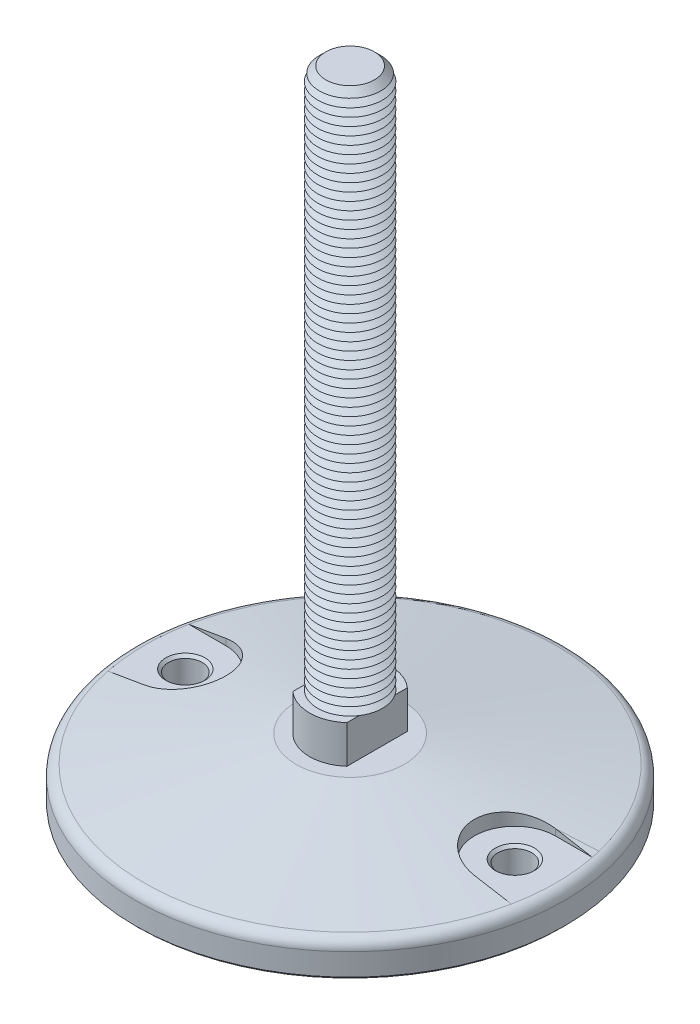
SolidWorks part; units mm, degrees
ref_plane "Front Plane" through (0, 0, 0) normal (0, 0, 1) x (1, 0, 0)
ref_plane "Top Plane" through (0, 0, 0) normal (0, 1, 0) x (1, 0, 0)
ref_plane "Right Plane" through (0, 0, 0) normal (1, 0, 0) x (0, 0, -1)
sketch "Sketch1" plane through (0, 0, 0) normal (1, 0, 0) x (0, 0, -1)
  line L0 (0, 61.3389) -> (0, -58.404) construction
sketch "Sketch2" plane through (0, 0, 0) normal (1, 0, 0) x (0, 0, -1)
  line L0 (0, 0) -> (-20, 0)
  line L1 (-20, 0) -> (-79.5, -10.4915)
  line L2 (-79.5, -10.4915) -> (-79.5, -23)
  line L3 (-79.5, -23) -> (0, -23)
  line L4 (0, 61.3389) -> (0, -58.404) construction
  line L5 (0, -23) -> (0, 0)
  dimension "D1" = 23
  dimension "D2" = 79.5
  dimension "D3" = 20
  dimension "D4" = 10
revolve "Revolve1" add sketch "Sketch2" angle 360 about L0
fillet "Fillet1" radius 4 1 edges at (0, -10.4915, 79.5)
sketch "Sketch3" plane through (0, 0, 0) normal (0, 1, 0) x (1, 0, 0)
  circle A0 centre (0, 0) radius 15
  dimension "D1" = 30
extrude "Boss-Extrude1" add sketch "Sketch3" along normal blind 14
sketch "Sketch4" plane through (0, 14, 0) normal (0, 1, 0) x (1, 0, 0)
  line L0 (-10, 11.1803) -> (-10, -11.1803)
  line L2 (10, -11.1803) -> (10, 11.1803)
  arc A0 (-10, 11.1803) -> (-10, -11.1803) centre (0, 0) ccw
  circle A1 centre (0, 0) radius 15 construction
  arc A2 (10, -11.1803) -> (10, 11.1803) centre (0, 0) ccw
  dimension "D1" = 20
extrude "Cut-Extrude1" cut sketch "Sketch4" against normal blind 14
sketch "Sketch5" plane through (0, 14, 0) normal (0, 1, 0) x (1, 0, 0)
  circle A0 centre (0, 0) radius 12
  dimension "D1" = 24
extrude "Boss-Extrude2" add sketch "Sketch5" along normal blind 200
chamfer "Chamfer1" distance 3 angle 45 1 edges at (0, 214, 12)
sketch "Sketch6" plane through (0, 0, 0) normal (1, 0, 0) x (0, 0, -1)
  line L0 (-12, 14) -> (-9.4019, 15.5)
  line L1 (-9.4019, 15.5) -> (-12, 17)
  line L2 (-12, 211) -> (-12, 14) construction
  line L3 (-12, 17) -> (-12, 14)
  dimension "D1" = 3
revolve "Cut-Revolve1" cut sketch "Sketch6" angle 360 about L0
pattern_linear "LPattern1" count 66 spacing 3 along (0, 1, 0) of "Cut-Revolve1"
sketch "Sketch8" plane through (0, 0, 0) normal (0, 1, 0) x (1, 0, 0)
  line L0 (-61, 15) -> (-74.7035, 15)
  line L1 (-61, -15) -> (-74.7035, -15)
  arc A1 (-74.7035, 15) -> (-74.7035, -15) centre (0, 0) ccw
  circle A2 centre (0, 0) radius 76.1946 construction
  arc A3 (-61, -15) -> (-61, 15) centre (-61, 0) ccw
  point P3 (-61, 0)
  point P11 (0, 0)
  dimension "D1" = 61
  dimension "D2" = 30
extrude "Cut-Extrude4" cut sketch "Sketch8" against normal blind 9.91
sketch "Sketch10" plane through (0, -9.91, 0) normal (0, 1, 0) x (1, 0, 0)
  circle A0 centre (-61, 0) radius 6.25
  dimension "D1" = 12.5
extrude "Cut-Extrude5" cut sketch "Sketch10" against normal up to surface (13.09 mm away)
chamfer "Chamfer2" distance 1 angle 45 2 edges at (-61, -23, -6.25) (-61, -9.91, 6.25)
mirror "Mirror1" about plane through (0, 0, 0) normal (1, 0, 0) of "Chamfer2", "Cut-Extrude5", "Cut-Extrude4"
chamfer "Chamfer3" distance 1 angle 45 1 edges at (0, -23, 79.5)
